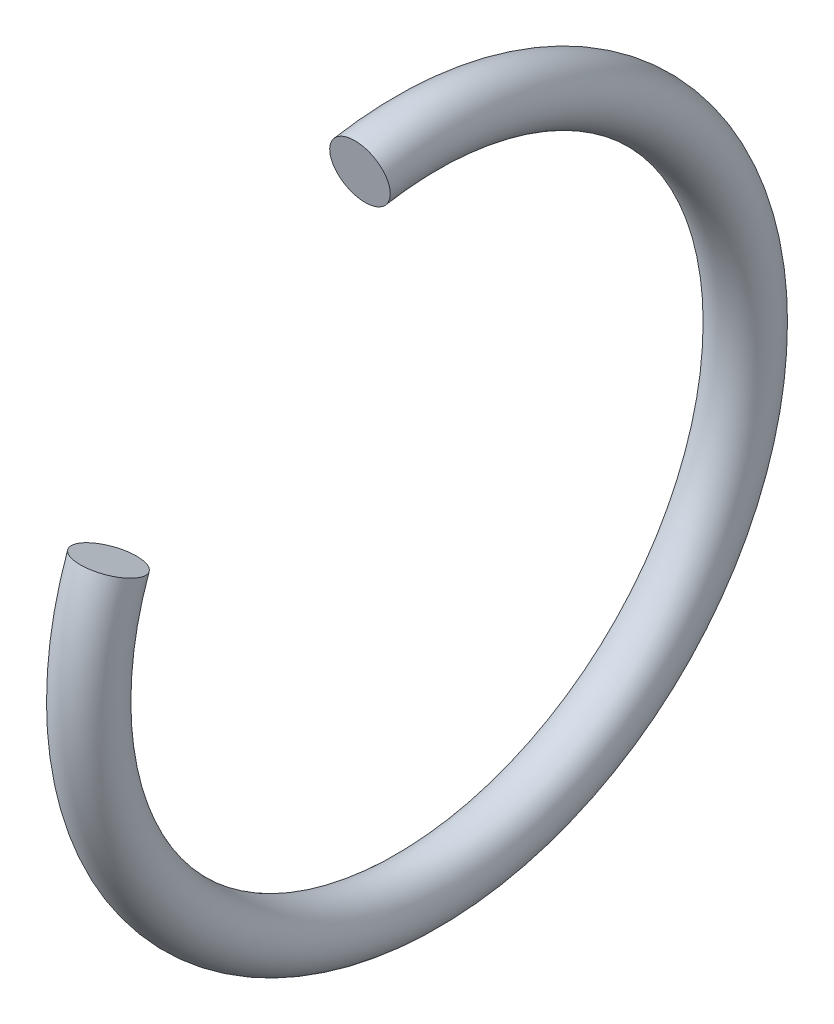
SolidWorks part; units mm, degrees
ref_plane "Plan1" through (0, 0, 0) normal (0, 0, 1) x (1, 0, 0)
ref_plane "Plan2" through (0, 0, 0) normal (0, 1, 0) x (1, 0, 0)
ref_plane "Plan3" through (0, 0, 0) normal (1, 0, 0) x (0, 0, -1)
sketch "Esquisse1" plane through (0, 0, 0) normal (0, 0, 1) x (1, 0, 0)
  line L0 (54.9, 5) -> (53.9, 5) construction
  line L1 (54.9, 5.5) -> (54.9, -5.5) construction
  line L2 (53.9, -5.5) -> (53.9, 5.5) construction
  line L3 (45.2, 0) -> (61.3907, 0) construction
  line L4 (41.4, 0) -> (59.9, 0) construction
  circle A0 centre (54.4, 5.5) radius 0.5
revolve "Base-Révolution" add sketch "Esquisse1" angle 10 about L3
ref_plane "Plan4" through (53.9, 0, 0) normal (1, 0, 0) x (0, 0, -1)
